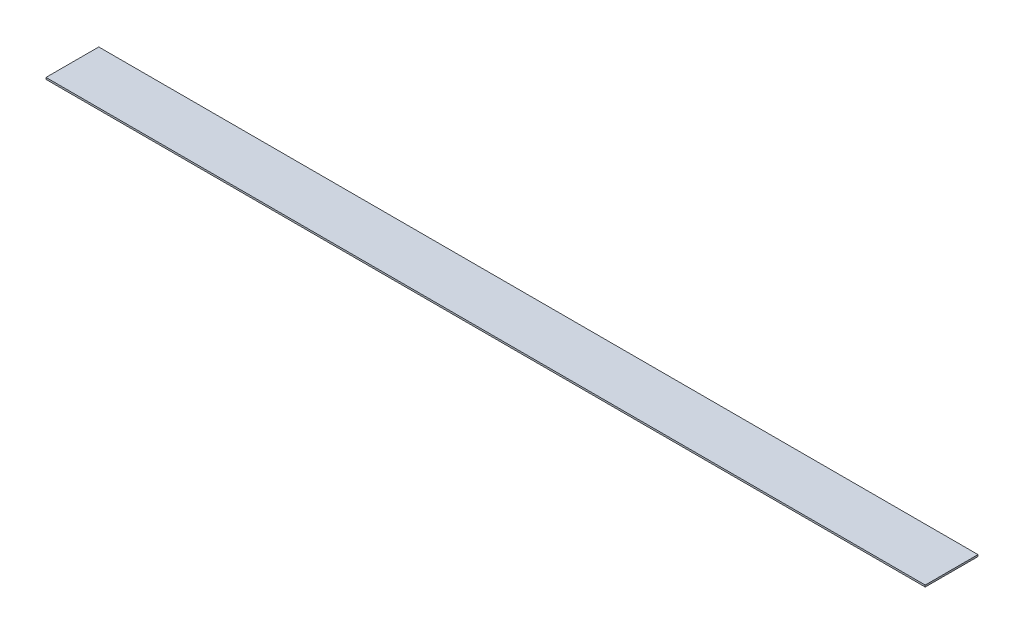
SolidWorks part; units mm, degrees
ref_plane "Front" through (0, 0, 0) normal (0, 0, 1) x (1, 0, 0)
ref_plane "Top" through (0, 0, 0) normal (0, 1, 0) x (1, 0, 0)
ref_plane "Right" through (0, 0, 0) normal (1, 0, 0) x (0, 0, -1)
sketch "Sketch1" plane through (0, 0, 0) normal (0, 1, 0) x (1, 0, 0)
  line L1 (0, -381) -> (12700, -381)
  line L2 (0, -381) -> (0, 381)
  line L3 (0, 381) -> (12700, 381)
  line L4 (12700, -381) -> (12700, 381)
  dimension "D1" = 12700
  dimension "D2" = 762
  dimension "D3" = 381
extrude "Extrude1" add sketch "Sketch1" against normal blind 25.4
